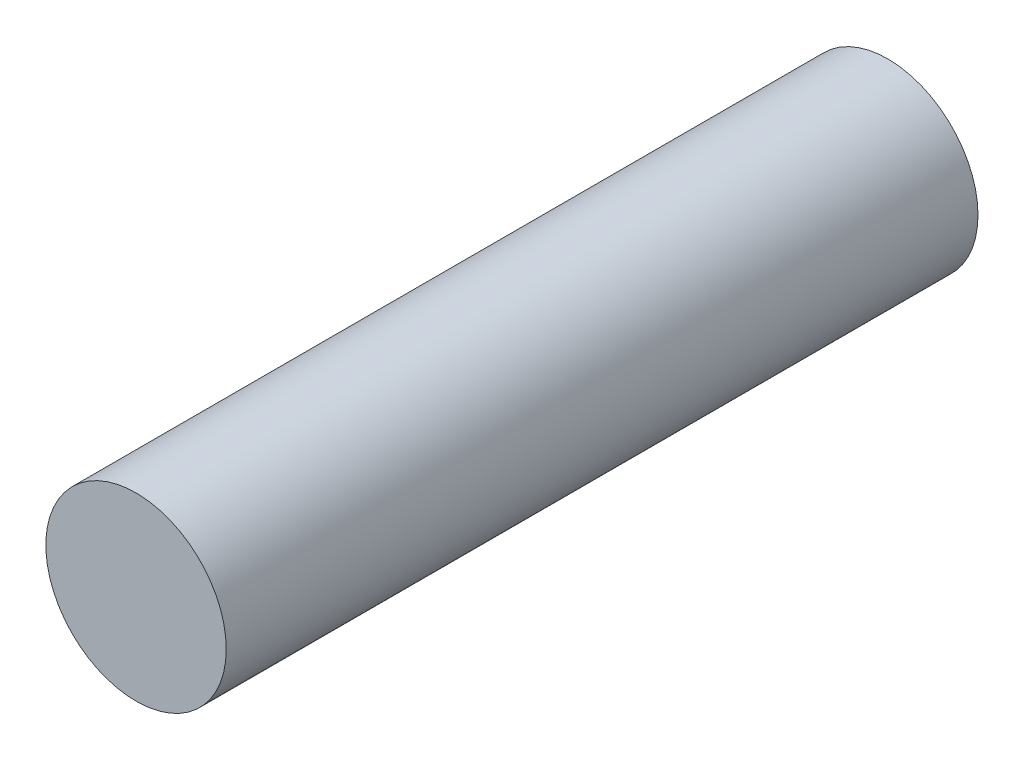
SolidWorks part; units mm, degrees
ref_plane "前基準面" through (0, 0, 0) normal (0, 0, 1) x (1, 0, 0)
ref_plane "上基準面" through (0, 0, 0) normal (0, 1, 0) x (1, 0, 0)
ref_plane "右基準面" through (0, 0, 0) normal (1, 0, 0) x (0, 0, -1)
sketch "草圖1" plane through (0, 0, 0) normal (0, 0, 1) x (1, 0, 0)
  circle A0 centre (0, 0) radius 6
  dimension "D1" = 12
extrude "填料-伸長1" add sketch "草圖1" along normal blind 50
